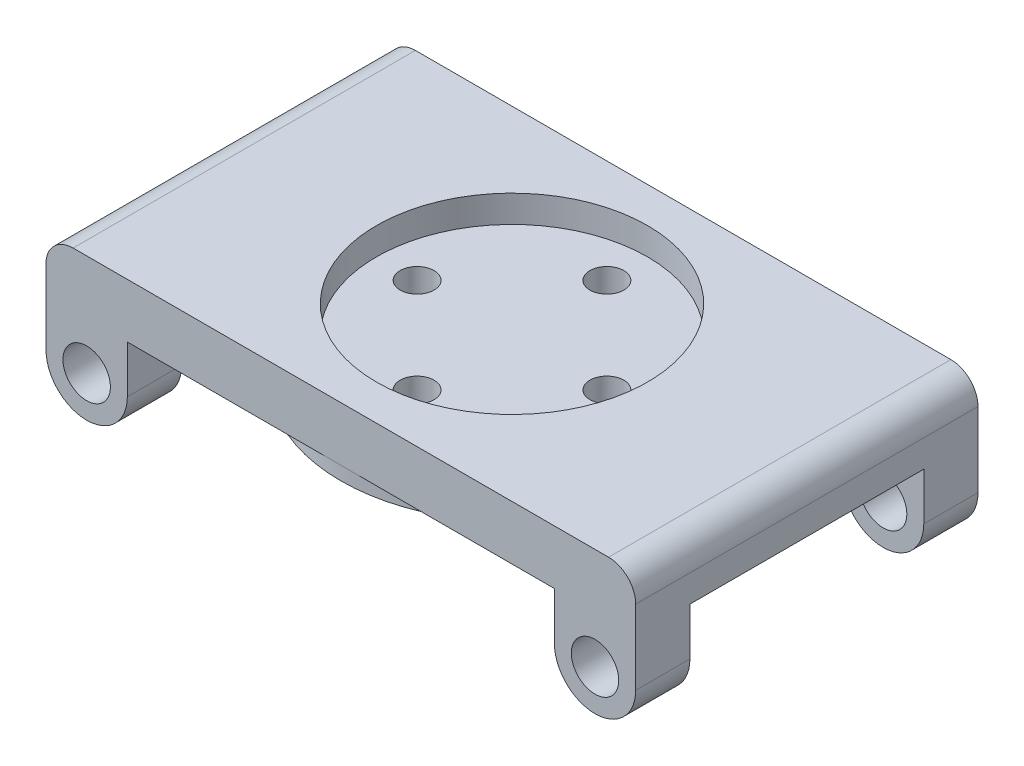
SolidWorks part; units mm, degrees
ref_plane "Front Plane" through (0, 0, 0) normal (0, 0, 1) x (1, 0, 0)
ref_plane "Top Plane" through (0, 0, 0) normal (0, 1, 0) x (1, 0, 0)
ref_plane "Right Plane" through (0, 0, 0) normal (1, 0, 0) x (0, 0, -1)
sketch "Sketch1" plane through (0, 0, 0) normal (0, 1, 0) x (1, 0, 0)
  line L1 (-21.75, -12.625) -> (21.75, -12.625)
  line L2 (-21.75, -12.625) -> (-21.75, 12.625)
  line L3 (-21.75, 12.625) -> (21.75, 12.625)
  line L4 (21.75, -12.625) -> (21.75, 12.625)
  line L5 (-21.75, -12.625) -> (21.75, 12.625) construction
  line L6 (-21.75, 12.625) -> (21.75, -12.625) construction
  point P0 (0, 0)
  dimension "D1" = 43.5
  dimension "D2" = 25.25
extrude "Boss-Extrude1" add sketch "Sketch1" along normal blind 4
sketch "Sketch5" plane through (0, 4, 0) normal (0, 1, 0) x (1, 0, 0)
  circle A0 centre (0, 0) radius 10
  dimension "D1" = 20
extrude "Cut-Extrude3" cut sketch "Sketch5" against normal blind 2
sketch "Sketch6" plane through (0, 0, 0) normal (0, -1, 0) x (1, 0, 0)
  line L0 (-21.75, 12.625) -> (21.75, 12.625) construction
  line L1 (21.75, -12.625) -> (-21.75, -12.625) construction
  circle A3 centre (0, 0) radius 12.625
extrude "Boss-Extrude3" add sketch "Sketch6" along normal blind 1
sketch "Sketch2" plane through (0, 4, 0) normal (0, 1, 0) x (1, 0, 0)
  circle A3 centre (0, 0) radius 7 construction
  circle A4 centre (0, 7) radius 1.25
  circle A5 centre (7, 0) radius 1.25
  circle A6 centre (0, -7) radius 1.25
  circle A7 centre (-7, 0) radius 1.25
  point P15 (0, 0)
  dimension "D1" = 2.5
  dimension "D2" = 14
  dimension "D3" = 4
extrude "Cut-Extrude4" cut sketch "Sketch2" against normal through all
sketch "Sketch4" plane through (0, 0, 12.625) normal (0, 0, 1) x (1, 0, 0)
  line L1 (-21.75, 0) -> (-15.75, 0)
  line L2 (-21.75, 0) -> (-21.75, -3.5)
  line L5 (0, 0) -> (0, 4) construction
  line L6 (-21.75, 4) -> (21.75, 4) construction
  line L8 (21.75, 0) -> (21.75, -3.5)
  line L9 (21.75, 0) -> (15.75, 0)
  line L11 (-21.75, 0) -> (0, 0)
  line L12 (15.75, 0) -> (21.75, 0)
  line L13 (-15.75, -3.5) -> (-15.75, 0)
  line L14 (15.75, -3.5) -> (15.75, 0)
  arc A0 (-21.75, -3.5) -> (-15.75, -3.5) centre (-18.75, -3.5) ccw
  circle A1 centre (-18.75, -3.5) radius 1.75
  circle A2 centre (18.75, -3.5) radius 1.75
  arc A3 (21.75, -3.5) -> (15.75, -3.5) centre (18.75, -3.5) cw
  dimension "D2" = 3
  dimension "D4" = 3.5
  dimension "D5" = 3.5
extrude "Boss-Extrude2" add sketch "Sketch4" against normal blind 4
mirror "Mirror1" about plane through (0, 0, 0) normal (0, 0, 1) of "Boss-Extrude2"
fillet "Fillet1" radius 2 2 edges at (21.75, 4, 0) (-21.75, 4, 0)
